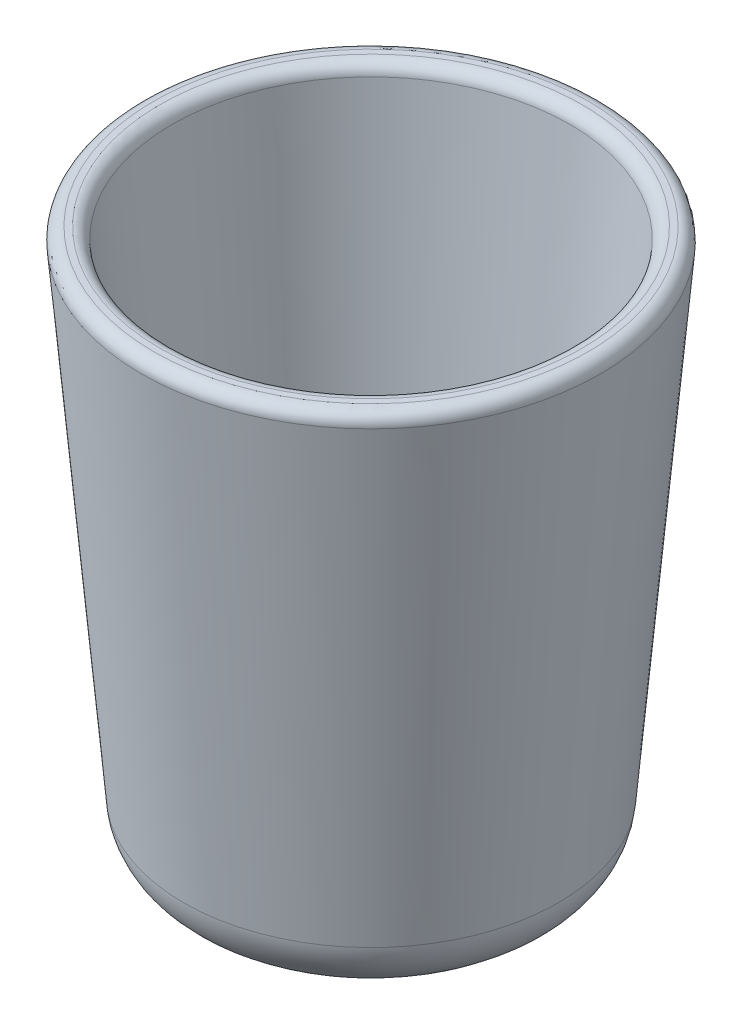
SolidWorks part; units mm, degrees
ref_plane "Front" through (0, 0, 0) normal (0, 0, 1) x (1, 0, 0)
ref_plane "Top" through (0, 0, 0) normal (0, 1, 0) x (1, 0, 0)
ref_plane "Right" through (0, 0, 0) normal (1, 0, 0) x (0, 0, -1)
sketch "Sketch1" plane through (0, 0, 0) normal (0, 1, 0) x (1, 0, 0)
  circle A0 centre (0, 0) radius 38.1
  dimension "cup-diameter" = 76.2
extrude "Base-Extrude" add sketch "Sketch1" along normal blind 114.3 draft 5
fillet "Fillet1" radius 12.7 1 edges at (0, 0, 38.1)
shell "Shell1" thickness 6.35
fillet "Fillet2" radius 2.54 2 edges at (0, 114.3, 48.1) (0, 114.3, 41.7257)
